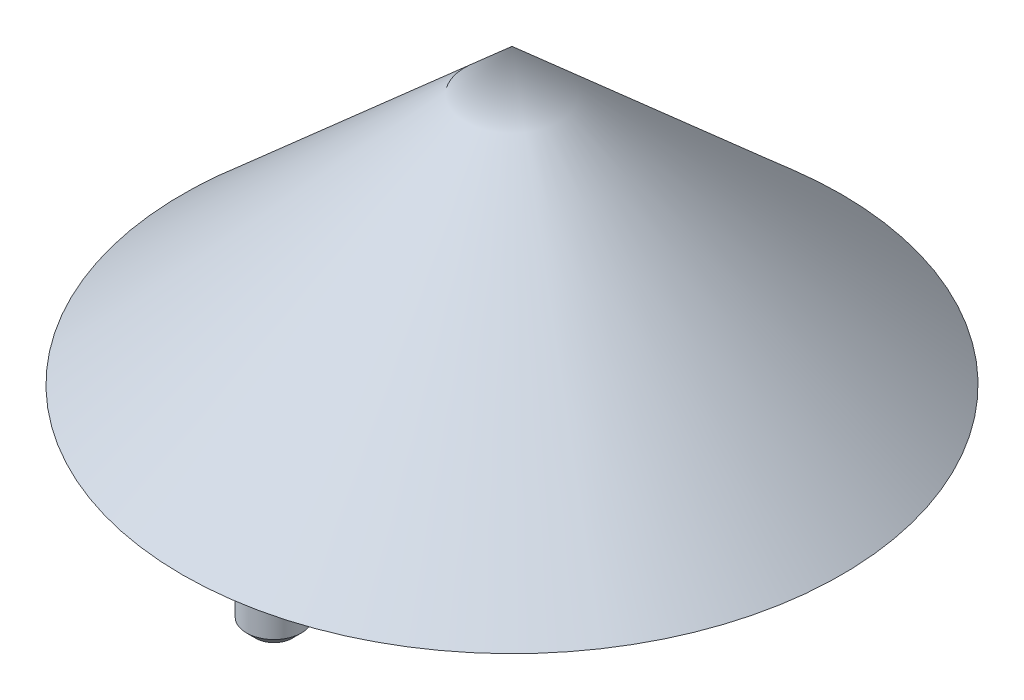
SolidWorks part; units mm, degrees
ref_plane "前视基准面" through (0, 0, 0) normal (0, 0, 1) x (1, 0, 0)
ref_plane "上视基准面" through (0, 0, 0) normal (0, 1, 0) x (1, 0, 0)
ref_plane "右视基准面" through (0, 0, 0) normal (1, 0, 0) x (0, 0, -1)
sketch "草图1" plane through (0, 0, 0) normal (0, 1, 0) x (1, 0, 0)
  circle A0 centre (0, 0) radius 18
  dimension "D1" = 36
sketch "草图2" plane through (0, 0, 0) normal (0, 0, 1) x (1, 0, 0)
  line L0 (0, 0) -> (0, 16)
  line L1 (0, 16) -> (18, 0)
  line L2 (18, 0) -> (-18, 0) construction
  line L3 (18, 0) -> (0, 0)
  dimension "D1" = 16
revolve "旋转1" add sketch "草图2" angle 360 about L0
sketch "草图3" plane through (0, 0, 0) normal (0, -1, 0) x (1, 0, 0)
  circle A0 centre (0, 13) radius 1.5
  circle A1 centre (-11.2583, -6.5) radius 1.5
  circle A2 centre (11.2583, -6.5) radius 1.5
  dimension "D1" = 3
  dimension "D2" = 3
  dimension "D3" = 3
  dimension "D4" = 13
  dimension "D5" = 13
  dimension "D6" = 13
extrude "凸台-拉伸1" add sketch "草图3" along normal blind 5
chamfer "倒角1" distance 0.5 angle 45 3 edges at (11.2583, -5, -8) (-11.2583, -5, -8) (0, -5, 11.5)
